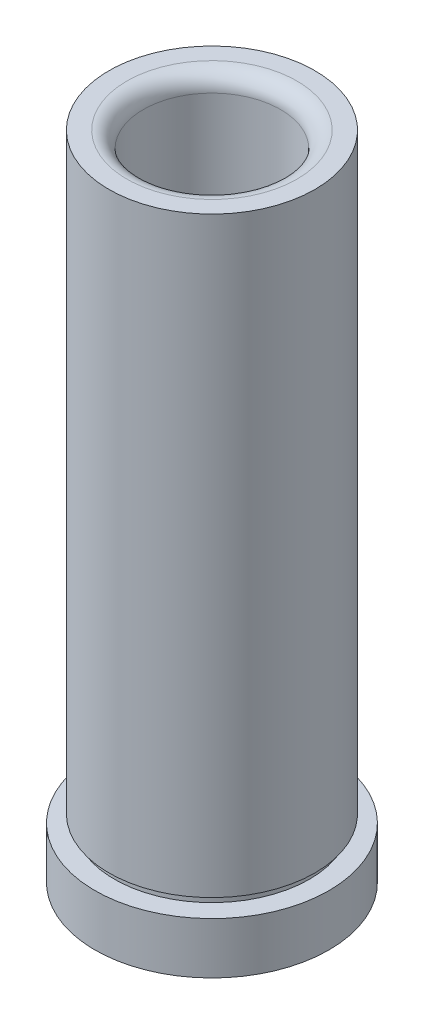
SolidWorks part; units mm, degrees
ref_plane "Front Plane" through (0, 0, 0) normal (0, 0, 1) x (1, 0, 0)
ref_plane "Top Plane" through (0, 0, 0) normal (0, 1, 0) x (1, 0, 0)
ref_plane "Right Plane" through (0, 0, 0) normal (1, 0, 0) x (0, 0, -1)
sketch "Sketch1" plane through (0, 0, 0) normal (0, 0, 1) x (1, 0, 0)
  line L0 (-1000, 0) -> (49000, 0) construction
  line L1 (0, -1000) -> (0, 49000) construction
  line L2 (-6.35, 60.325) -> (-6.35, 34.925)
  line L3 (-7.112, 0) -> (-10.8331, 0)
  line L4 (-10.8331, 0) -> (-10.8331, 4.7625)
  line L5 (-10.8331, 4.7625) -> (-9.0233, 4.7625)
  line L6 (-9.5314, 60.325) -> (-9.5313, 5.5245)
  line L7 (-9.5314, 60.325) -> (-6.35, 60.325)
  line L8 (-6.35, 34.925) -> (-7.112, 34.163)
  line L9 (-7.112, 34.163) -> (-7.112, 0)
  line L10 (-9.5313, 5.5245) -> (-9.0233, 5.5245)
  line L11 (-9.0233, 5.5245) -> (-9.0233, 4.7625)
  dimension "D1" = 0.508
  dimension "OD" = 19.0627
  dimension "ID" = 12.7
  dimension "FLANGETHICKNESS" = 4.7625
  dimension "FLANGEDIA" = 21.6662
  dimension "D2" = 0.762
  dimension "D3" = 0.762
  dimension "OVERALL LENGTH" = 60.325
  dimension "D4" = 45
  dimension "BEARINGSURFACE" = 25.4
revolve "Revolve1" add sketch "Sketch1" angle 360 about L1
fillet "Fillet1" radius 1.524 1 edges at (6.35, 60.325, 0)
chamfer "Chamfer1" distance 1.524 angle 45 1 edges at (7.112, 0, 0)
